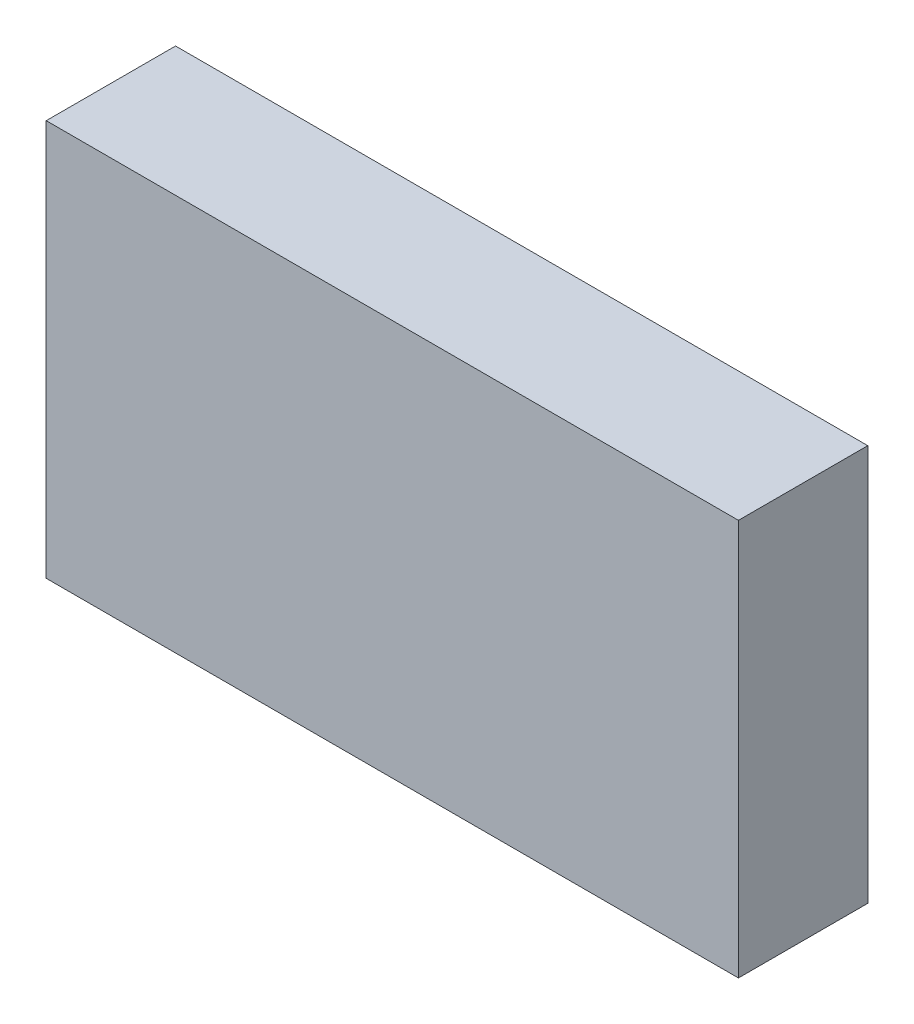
SolidWorks part; units mm, degrees
ref_plane "Front Plane" through (0, 0, 0) normal (1, 0, 0) x (0, 1, 0)
ref_plane "Top Plane" through (0, 0, 0) normal (0, 0, 1) x (0, 1, 0)
ref_plane "Right Plane" through (0, 0, 0) normal (0, 1, 0) x (-1, 0, 0)
sketch "Sketch1" plane through (0, 0, 0) normal (0, 0, 1) x (0, 1, 0)
  line L1 (-311.3905, 543.814) -> (311.3905, 543.814)
  line L2 (-311.3905, 543.814) -> (-311.3905, -543.814)
  line L3 (-311.3905, -543.814) -> (311.3905, -543.814)
  line L4 (311.3905, 543.814) -> (311.3905, -543.814)
  line L5 (-311.3905, 543.814) -> (311.3905, -543.814) construction
  line L6 (-311.3905, -543.814) -> (311.3905, 543.814) construction
  point P0 (0, 0)
  dimension "D1" = 1087.628
  dimension "D2" = 622.781
extrude "Boss-Extrude1" add sketch "Sketch1" along normal mid plane 203.2
